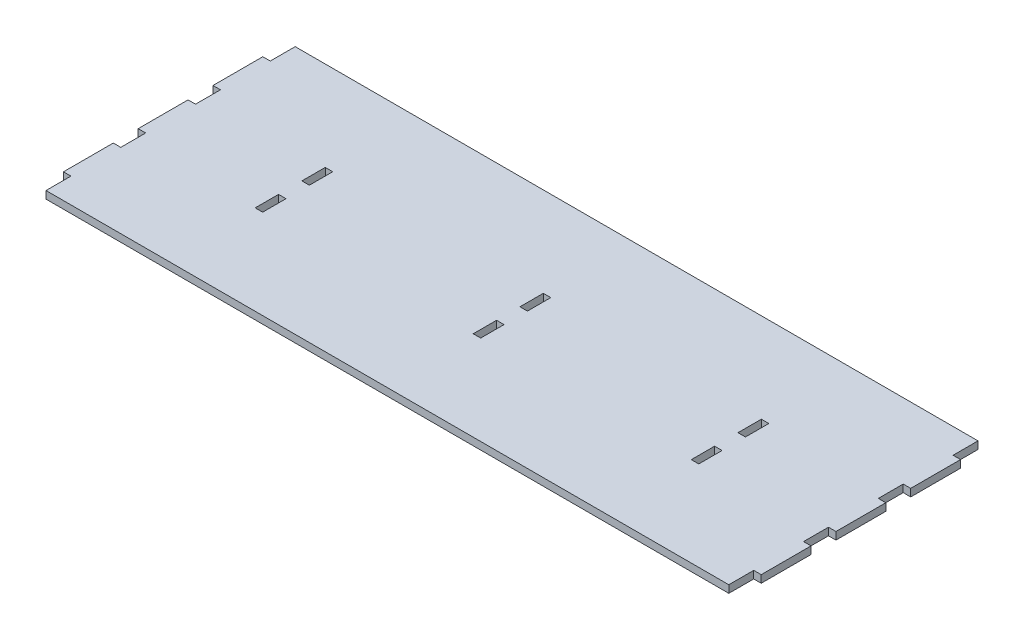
SolidWorks part; units mm, degrees
ref_plane "Alzado" through (0, 0, 0) normal (0, 0, 1) x (1, 0, 0)
ref_plane "Planta" through (0, 0, 0) normal (0, 1, 0) x (1, 0, 0)
ref_plane "Vista lateral" through (0, 0, 0) normal (1, 0, 0) x (0, 0, -1)
sketch "Croquis1" plane through (0, 0, 0) normal (0, 1, 0) x (1, 0, 0)
  line L0 (-560, -40) -> (-560, 40)
  line L1 (-548, -200) -> (548, -200)
  line L2 (-548, -200) -> (-548, -160)
  line L3 (-548, 200) -> (548, 200)
  line L4 (548, -200) -> (548, -160)
  line L5 (-548, -200) -> (548, 200) construction
  line L6 (-548, 200) -> (548, -200) construction
  line L7 (-548, -160) -> (-560, -160)
  line L9 (-548, -80) -> (-560, -80)
  line L10 (-560, -160) -> (-560, -80)
  line L11 (-548, 40) -> (-560, 40)
  line L13 (-548, -40) -> (-560, -40)
  line L14 (-560, 80) -> (-560, 160)
  line L15 (-548, 160) -> (-560, 160)
  line L17 (-548, 80) -> (-560, 80)
  line L18 (0, 200) -> (0, 142.0008) construction
  line L19 (548, -160) -> (560, -160)
  line L21 (548, -80) -> (560, -80)
  line L22 (560, -160) -> (560, -80)
  line L23 (548, -40) -> (560, -40)
  line L25 (548, 40) -> (560, 40)
  line L26 (560, -40) -> (560, 40)
  line L27 (548, 80) -> (560, 80)
  line L29 (548, 160) -> (560, 160)
  line L30 (560, 80) -> (560, 160)
  line L31 (-548, 160) -> (-548, 200)
  line L33 (-548, 40) -> (-548, 80)
  line L35 (-548, -80) -> (-548, -40)
  line L36 (548, 160) -> (548, 200)
  line L37 (548, 40) -> (548, 80)
  line L38 (548, -80) -> (548, -40)
  line L40 (-467.84, 0) -> (-435.4874, 0) construction
  point P0 (0, 0)
  point P46 (0, -154)
  point P52 (0, 154)
sketch "Croquis2" plane through (0, 0, 0) normal (1, 0, 0) x (0, 0, -1)
  line L1 (147.5, -6.5) -> (160.5, -6.5)
  line L2 (147.5, -6.5) -> (147.5, 6.5)
  line L3 (147.5, 6.5) -> (160.5, 6.5)
  line L4 (160.5, -6.5) -> (160.5, 6.5)
  line L5 (147.5, -6.5) -> (160.5, 6.5) construction
  line L6 (147.5, 6.5) -> (160.5, -6.5) construction
  point P0 (154, 0)
sketch "Croquis3" plane through (0, 0, 0) normal (0, 1, 0) x (1, 0, 0)
  line L0 (368, 154) -> (-368, 154)
  line L1 (-508, 14) -> (-508, 0)
  line L2 (-508, -14) -> (-508, 0)
  line L3 (368, -154) -> (-368, -154)
  line L4 (508, -14) -> (508, 0)
  line L5 (508, 14) -> (508, 0)
  arc A0 (-368, 154) -> (-508, 14) centre (-368, 14) ccw
  arc A1 (-368, -154) -> (-508, -14) centre (-368, -14) cw
  arc A2 (368, -154) -> (508, -14) centre (368, -14) ccw
  arc A3 (368, 154) -> (508, 14) centre (368, 14) cw
  point P10 (0, -154)
  point P16 (0, 154)
extrude "Saliente-Extruir1" add sketch "Croquis1" along normal blind 12
sweep "Cortar-Barrer1" cut profiles "Croquis2" path "Croquis3"
ref_plane "Plano4" through (0, 0, 0) normal (0, -1, 0) x (-1, 0, 0)
sketch "Croquis4" plane through (0, 0, 0) normal (0, -1, 0) x (-1, 0, 0)
  line L0 (0, -35.0599) -> (0, 79.3714) construction
  line L1 (-55.8016, 0) -> (67.2121, 0) construction
  line L3 (-6, 56.25) -> (6, 56.25)
  line L4 (-6, 56.25) -> (-6, 18.75)
  line L5 (-6, 18.75) -> (6, 18.75)
  line L6 (6, 56.25) -> (6, 18.75)
  line L7 (-6, 56.25) -> (6, 18.75) construction
  line L8 (-6, 18.75) -> (6, 56.25) construction
  line L9 (-6, -56.25) -> (6, -56.25)
  line L10 (-6, -56.25) -> (-6, -18.75)
  line L11 (-6, -18.75) -> (6, -18.75)
  line L12 (6, -56.25) -> (6, -18.75)
  line L13 (356, 56.25) -> (356, 18.75)
  line L14 (344, 18.75) -> (356, 18.75)
  line L15 (344, 56.25) -> (344, 18.75)
  line L16 (344, 56.25) -> (356, 56.25)
  line L17 (356, -56.25) -> (356, -18.75)
  line L18 (344, -18.75) -> (356, -18.75)
  line L19 (344, -56.25) -> (344, -18.75)
  line L20 (344, -56.25) -> (356, -56.25)
  line L21 (-344, 56.25) -> (-344, 18.75)
  line L22 (-356, 18.75) -> (-344, 18.75)
  line L23 (-356, 56.25) -> (-356, 18.75)
  line L24 (-356, 56.25) -> (-344, 56.25)
  line L25 (-344, -56.25) -> (-344, -18.75)
  line L26 (-356, -18.75) -> (-344, -18.75)
  line L27 (-356, -56.25) -> (-356, -18.75)
  line L28 (-356, -56.25) -> (-344, -56.25)
  point P5 (0, 37.5)
extrude "Cortar-Extruir1" cut sketch "Croquis4" against normal blind 12
equation "\"ancho\"=40"
equation "\"D2@Croquis1\"=\"ancho\""
equation "\"largo\"=112"
equation "\"material\"= 1.2"
equation "\"D1@Croquis1\"=\"largo\"-(\"material\"*2)"
equation "\"ancho_joint_sep\"=4"
equation "\"D3@Croquis1\"=\"ancho_joint_sep\""
equation "\"ancho_joint\"=8"
equation "\"D4@Croquis1\"=\"ancho_joint\""
equation "\"D5@Croquis1\"=\"material\""
equation "\"D7@Croquis1\"=\"ancho_joint_sep\""
equation "\"manija\"= 4"
equation "\"D1@Croquis2\"=\"material\"+0.1"
equation "\"D2@Croquis2\"=\"material\"+0.1"
equation "\"D1@Saliente-Extruir1\"=\"material\""
equation "\"joints\"=3.75"
equation "\"D1@Croquis4\"=\"joints\""
equation "\"D2@Croquis4\"=\"material\""
equation "\"D3@Croquis4\"=\"joints\"/2"
